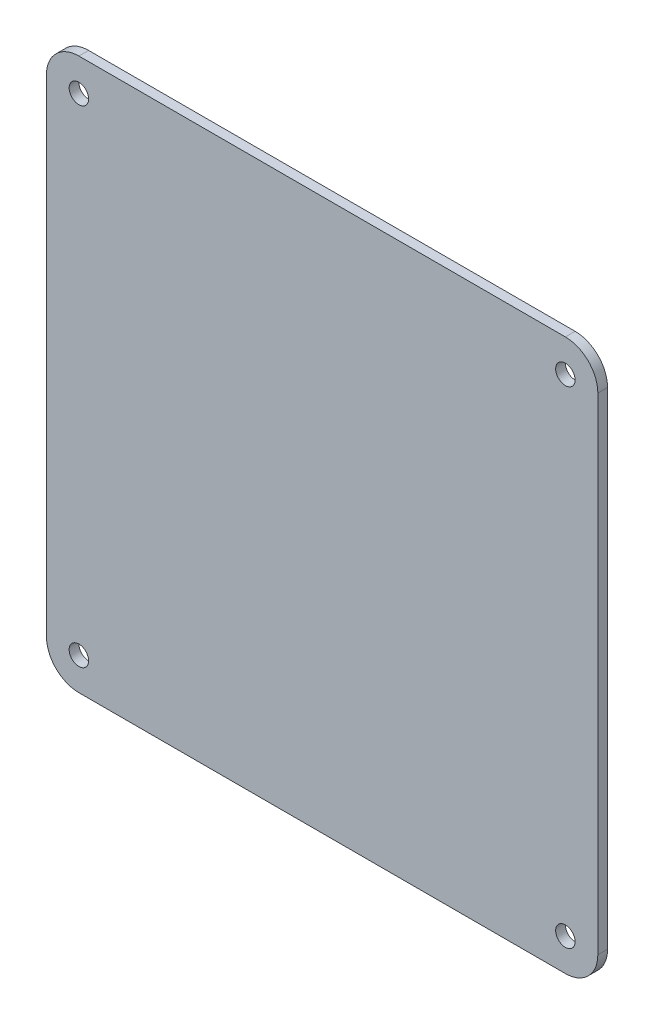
SolidWorks part; units mm, degrees
ref_plane "Front Plane" through (0, 0, 0) normal (0, 0, 1) x (1, 0, 0)
ref_plane "Top Plane" through (0, 0, 0) normal (0, 1, 0) x (1, 0, 0)
ref_plane "Right Plane" through (0, 0, 0) normal (1, 0, 0) x (0, 0, -1)
sketch "Sketch1" plane through (0, 0, 0) normal (0, 0, 1) x (1, 0, 0)
  line L0 (0, 85) -> (0, -85) construction
  line L1 (75, -85) -> (-75, -85)
  line L2 (85, -75) -> (85, 75)
  line L3 (75, 85) -> (-75, 85)
  line L4 (-85, -75) -> (-85, 75)
  line L5 (85, -85) -> (-85, 85) construction
  line L6 (85, 85) -> (-85, -85) construction
  line L7 (-85, 0) -> (85, 0) construction
  arc A0 (75, -85) -> (85, -75) centre (75, -75) ccw
  arc A1 (85, 75) -> (75, 85) centre (75, 75) ccw
  arc A2 (-75, 85) -> (-85, 75) centre (-75, 75) ccw
  arc A3 (-75, -85) -> (-85, -75) centre (-75, -75) cw
  circle A4 centre (-75, 75) radius 3
  circle A5 centre (75, 75) radius 3
  circle A6 centre (75, -75) radius 3
  circle A7 centre (-75, -75) radius 3
  point P0 (0, 0)
  dimension "D3" = 10
  dimension "D4" = 6
  dimension "D1" = 170
  dimension "D2" = 170
extrude "Boss-Extrude1" add sketch "Sketch1" along normal blind 3
